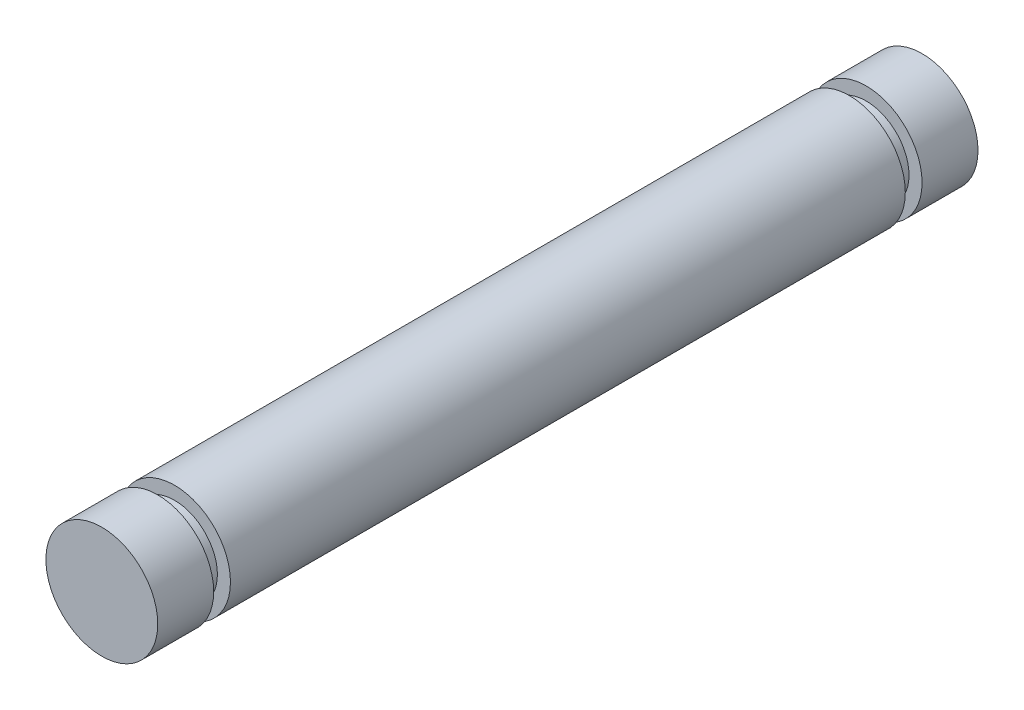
SolidWorks part; units mm, degrees
ref_plane "Plan médian" through (0, 0, 0) normal (0, 0, 1) x (1, 0, 0)
ref_plane "Plan2" through (0, 0, 0) normal (0, 1, 0) x (1, 0, 0)
ref_plane "Plan3" through (0, 0, 0) normal (1, 0, 0) x (0, 0, -1)
sketch "Esquisse1" plane through (0, 0, 0) normal (0, 0, 1) x (1, 0, 0)
  circle A0 centre (-14.75, 36) radius 1.5 construction
  circle A1 centre (-14.75, 36) radius 1.5
extrude "Base-Extrusion" add sketch "Esquisse1" along normal mid plane 22
sketch "Esquisse2" plane through (0, 0, 9.5) normal (0, 0, 1) x (1, 0, 0)
  circle A0 centre (-14.75, 36) radius 1.15
  circle A1 centre (-14.75, 36) radius 1.5 construction
  arc A2 (-13.7036, 35.5229) -> (-13.6, 36) centre (-14.75, 36) ccw construction
  circle A3 centre (-14.75, 36) radius 1.5
extrude "Enlèv. mat.-Extru.1" cut sketch "Esquisse2" against normal blind 0.45
mirror "Symétrie1" about plane through (0, 0, 0) normal (0, 0, 1)
